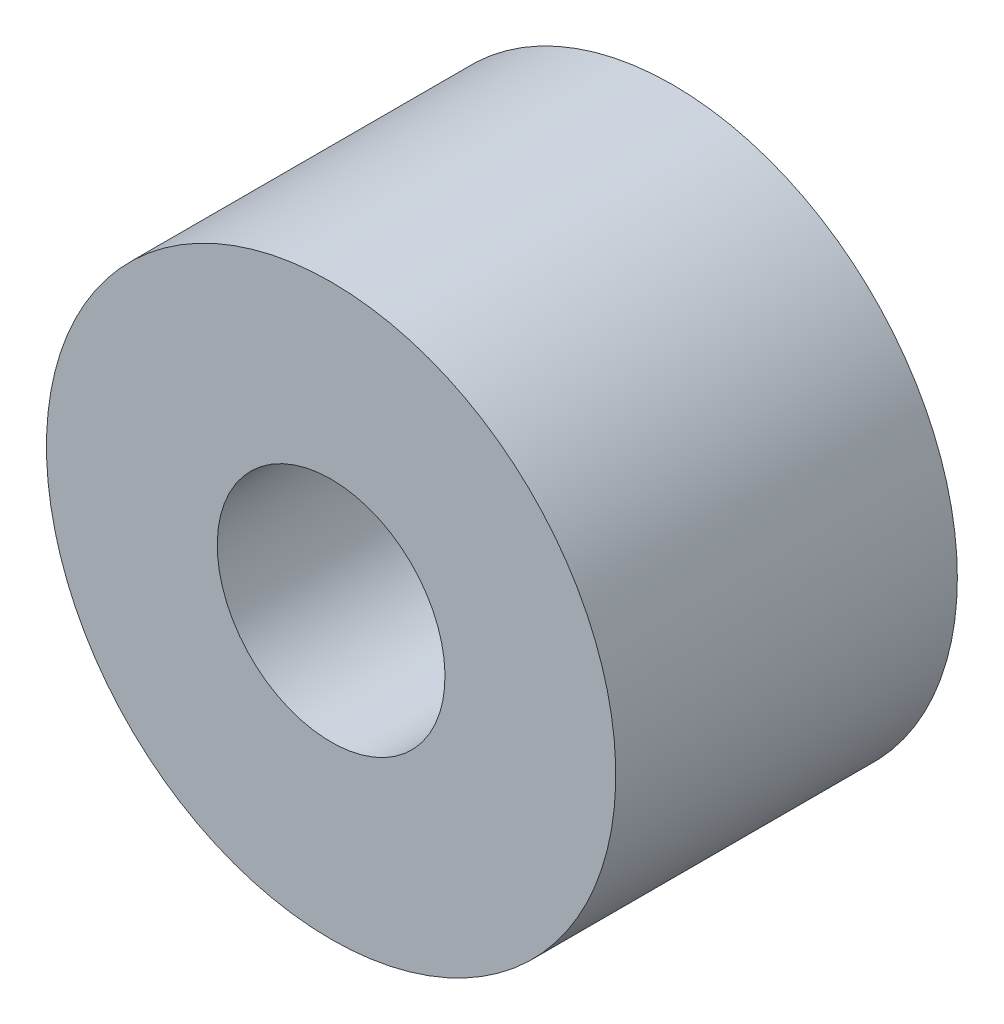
SolidWorks part; units mm, degrees
ref_plane "Front Plane" through (0, 0, 0) normal (0, 0, 1) x (1, 0, 0)
ref_plane "Top Plane" through (0, 0, 0) normal (0, 1, 0) x (1, 0, 0)
ref_plane "Right Plane" through (0, 0, 0) normal (1, 0, 0) x (0, 0, -1)
sketch "Sketch2" plane through (0, 0, 173.9482) normal (0, 0, 1) x (1, 0, 0)
  line L1 (-31.7299, 224.5472) -> (-74.1162, 224.5472) construction
  circle A1 centre (25.5875, 69.7552) radius 2
  circle A4 centre (25.5875, 69.7552) radius 5
  dimension "D1" = 4
  dimension "D2" = 10
  dimension "D3" = 99.7037
  dimension "D4" = 154.7921
extrude "Boss-Extrude1" add sketch "Sketch2" along normal up to surface (6 mm away) contours A4 | A1
